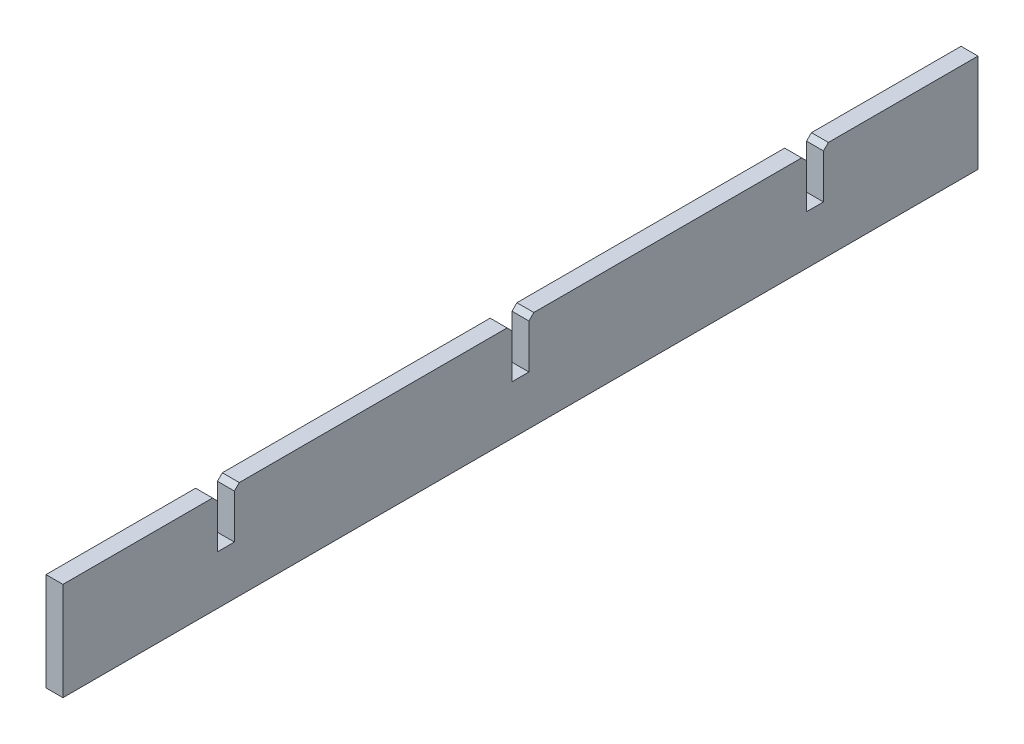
SolidWorks part; units mm, degrees
ref_plane "Front Plane" through (0, 0, 0) normal (0, 0, 1) x (1, 0, 0)
ref_plane "Top Plane" through (0, 0, 0) normal (0, 1, 0) x (1, 0, 0)
ref_plane "Right Plane" through (0, 0, 0) normal (1, 0, 0) x (0, 0, -1)
sketch "Sketch1" plane through (0, 0, 0) normal (1, 0, 0) x (0, 0, -1)
  line L1 (-466, -50) -> (466, -50)
  line L2 (-466, -50) -> (-466, 50)
  line L3 (-466, 50) -> (466, 50)
  line L4 (466, -50) -> (466, 50)
  line L5 (-466, -50) -> (466, 50) construction
  line L6 (-466, 50) -> (466, -50) construction
  point P0 (0, 0)
  dimension "D1" = 932
  dimension "D2" = 100
extrude "Support" add sketch "Sketch1" along normal blind 17.25
sketch "Sketch3" plane through (0, 0, 0) normal (1, 0, 0) x (0, 0, -1)
  line L0 (0, 0) -> (0, 74.7583) construction
  line L1 (466, 50) -> (-466, 50) construction
  line L2 (0, 0) -> (-8.625, 0)
  line L3 (0, 0) -> (0, 50)
  line L4 (0, 50) -> (-8.625, 50)
  line L5 (-8.625, 0) -> (-8.625, 50)
  dimension "D1" = 8.625
extrude "Cut-Extrude2" cut sketch "Sketch3" against normal blind 18 from surface at 17.25
mirror "Mirror1" about plane through (0, 0, 0) normal (0, 0, 1) of "Cut-Extrude2"
chamfer "Chamfer1" distance 5 angle 45 2 edges at (8.625, 50, -8.625) (8.625, 50, 8.625)
pattern_linear "LPattern2" count 2 spacing 300 along (0, 0, 1) count 2 spacing 300 along (0, 0, -1) of "Cut-Extrude2", "Mirror1", "Chamfer1"
